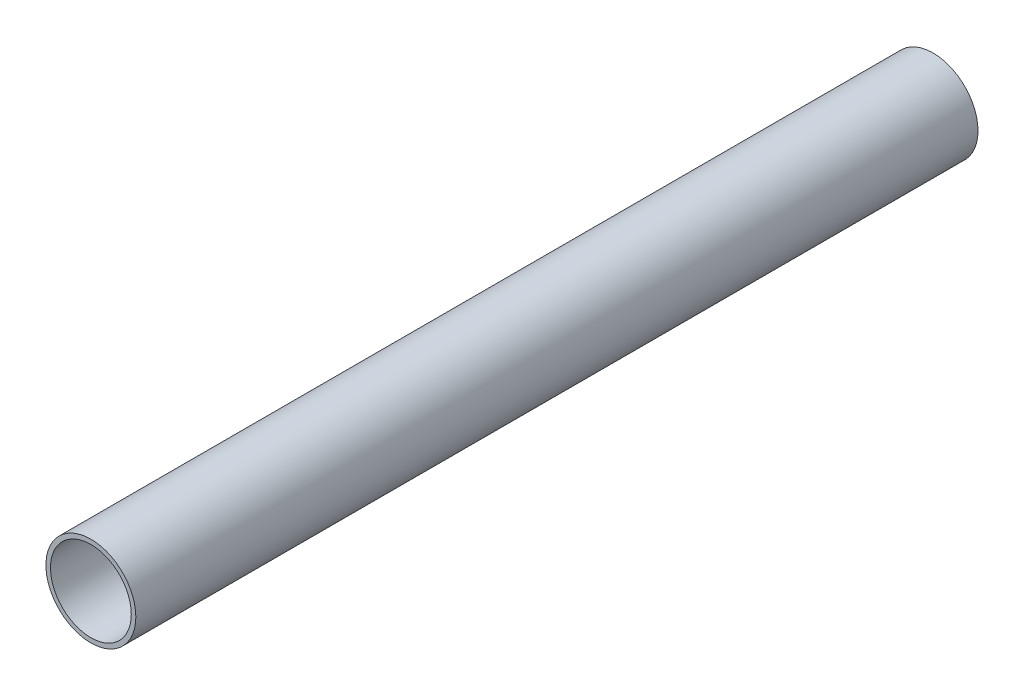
SolidWorks part; units mm, degrees
ref_plane "Front Plane" through (0, 0, 0) normal (0, 0, 1) x (1, 0, 0)
ref_plane "Top Plane" through (0, 0, 0) normal (0, 1, 0) x (1, 0, 0)
ref_plane "Right Plane" through (0, 0, 0) normal (1, 0, 0) x (0, 0, -1)
sketch "Sketch1" plane through (0, 0, 0) normal (0, 0, 1) x (1, 0, 0)
  circle A0 centre (-54.4028, 21.6263) radius 5.0165
  circle A1 centre (-54.4028, 21.6263) radius 4.5085
  dimension "D1" = 10.033
  dimension "D2" = 0.508
extrude "Boss-Extrude1" add sketch "Sketch1" along normal blind 93.98
